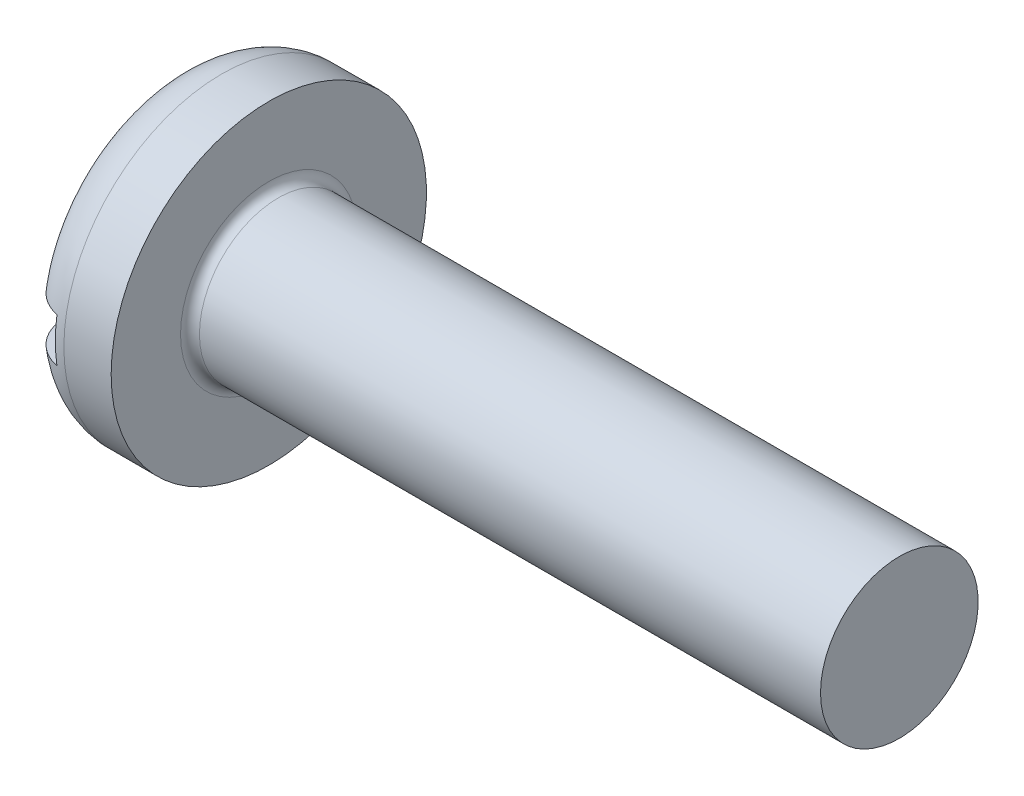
SolidWorks part; units mm, degrees
ref_plane "Front Plane" through (0, 0, 0) normal (0, 0, 1) x (1, 0, 0)
ref_plane "Top Plane" through (0, 0, 0) normal (0, 1, 0) x (1, 0, 0)
ref_plane "Right Plane" through (0, 0, 0) normal (1, 0, 0) x (0, 0, -1)
sketch "BodySke" plane through (0, 0, 0) normal (0, 0, 1) x (1, 0, 0)
  line L0 (0, 0) -> (111.3824, 0) construction
  line L1 (0, 0) -> (0, 10)
  line L2 (0, 10) -> (6, 10)
  line L3 (6, 10) -> (6, 5)
  line L4 (6, 5) -> (46, 5)
  line L5 (46, 5) -> (46, 0)
  line L6 (7.5, 8.824) -> (7.5, -5.8939) construction
  line L7 (0, 0) -> (46, 0)
  line L8 (9, 8.824) -> (9, -5.8939) construction
  point P10 (46, 4.172)
  dimension "Diameter" = 10
  dimension "Head_dia" = 20
  dimension "Head_height" = 6
  dimension "Length" = 40
  dimension "Advance" = 1.5
  dimension "Thread_minor" = 8.344
  dimension "Thread_runout" = 3
revolve "BaseBody" add sketch "BodySke" angle 360 about L0
fillet "Fillet_head" radius 3 1 edges at (0, 0, 10)
fillet "Fillet2" radius 0.6 1 edges at (6, 0, 5)
sketch "SlotSke" plane through (0, 0, 0) normal (-1, 0, 0) x (0, 0, 1)
  line L1 (-10, 1.405) -> (10, 1.405)
  line L2 (-10, 1.405) -> (-10, -1.405)
  line L3 (-10, -1.405) -> (10, -1.405)
  line L4 (10, 1.405) -> (10, -1.405)
  dimension "D1" = 20
  dimension "D2" = 10
  dimension "D3" = 1.405
  dimension "Slot_width" = 2.81
extrude "Slot" cut sketch "SlotSke" against normal blind 2.4
sketch "ThdSchSke" plane through (0, 0, 0) normal (0, 0, 1) x (1, 0, 0)
  line L0 (0, 0) -> (55.1256, 0) construction
  line L1 (0, 0) -> (111.3824, 0) construction
  line L2 (45.522, 5) -> (45.522, 5.9561)
  line L3 (45.522, 5.9561) -> (46.478, 5.9561)
  line L4 (46.478, 5.9561) -> (46.478, 5)
  line L5 (46.478, 5) -> (46, 4.172)
  line L6 (46, 4.172) -> (45.522, 5)
  line L7 (6, 5) -> (46, 5) construction
  line L13 (46, 5) -> (46, 0) construction
revolve "ThreadSchematic" [suppressed] cut sketch "ThdSchSke" angle 360 about L0
pattern_linear "ThdSchPat" [suppressed] count 25 along (1, 0, 0)
equation "\"Thread_minor@ThreadCosmetic\" = \"Thread_minor@BodySke\""
equation "\"D1@SlotSke\" = \"Head_dia@BodySke\""
equation "\"D2@SlotSke\" = \"D1@SlotSke\" / 2"
equation "\"D3@SlotSke\" = \"Slot_width@SlotSke\" / 2"
equation "\"Advance@ThdSchPat\" = \"Advance@BodySke\""
equation "\"D1@ThdSchPat\" =  int(  ( \"Length@BodySke\"-\"Thread_runout@BodySke\" )  /\"Advance@ThdSchPat\" )  + 1"
